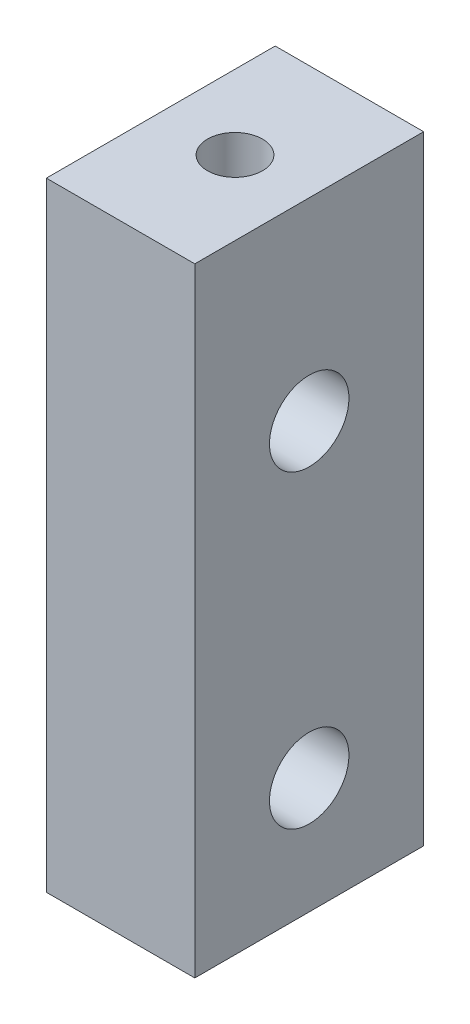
SolidWorks part; units mm, degrees
ref_plane "Front Plane" through (0, 0, 0) normal (0, 0, 1) x (1, 0, 0)
ref_plane "Top Plane" through (0, 0, 0) normal (0, 1, 0) x (1, 0, 0)
ref_plane "Right Plane" through (0, 0, 0) normal (1, 0, 0) x (0, 0, -1)
sketch "Sketch1" plane through (0, 0, 0) normal (1, 0, 0) x (0, 0, -1)
  line L1 (0, 0) -> (9.398, 0)
  line L2 (0, 0) -> (0, -25.4)
  line L3 (0, -25.4) -> (9.398, -25.4)
  line L4 (9.398, 0) -> (9.398, -25.4)
  dimension "D1" = 9.398
  dimension "D2" = 25.4
extrude "Extrude1" add sketch "Sketch1" along normal blind 6.096
hole_wizard "#4 Clearance Hole1" positions "Sketch3" profile "Sketch2" hole size "#4" standard "Ansi Inch"
sketch "Sketch3" plane through (6.096, 0, 0) normal (1, 0, 0) x (0, 0, -1)
  line L0 (9.398, -25.4) -> (9.398, 0) construction
  line L1 (9.398, 0) -> (0, 0) construction
  point P0 (4.699, -7.9375)
  point P1 (4.699, -20.6375)
  dimension "D1" = 4.699
  dimension "D2" = 7.9375
  dimension "D3" = 4.699
  dimension "D4" = 12.7
sketch "Sketch2" plane through (6.096, -7.9375, -4.699) normal (0, 1, 0) x (0, 0, -1)
  line L0 (0, 0) -> (0, 14.224)
  line L1 (0, 14.224) -> (1.6319, 14.224)
  line L2 (1.6319, 14.224) -> (1.6319, 0)
  line L5 (1.6319, 0) -> (0, 0)
  line L10 (0, 14.224) -> (-1.632, 14.224) construction
  line L11 (0, -6.35) -> (0, 107.95) construction
  dimension "Hole Dia." = 3.2639
  dimension "Hole Depth" = 14.224
  dimension "Drill Angle" = 180
hole_wizard "#4-40 Tapped Hole1" positions "Sketch5" profile "Sketch4" tap size "#4-40" standard "Ansi Inch"
sketch "Sketch5" plane through (0, 0, 0) normal (0, 1, 0) x (-1, 0, 0)
  line L0 (-6.096, 0) -> (0, 0) construction
  line L1 (0, -9.398) -> (0, 0) construction
  point P0 (-3.048, -4.699)
  dimension "D1" = 4.699
  dimension "D2" = 3.048
sketch "Sketch4" plane through (3.048, 0, -4.699) normal (1, 0, 0) x (0, 0, 1)
  line L0 (0, 0) -> (0, 5.7592)
  line L1 (0, 5.7592) -> (1.1303, 5.08)
  line L2 (1.1303, 5.08) -> (1.1303, 0)
  line L5 (1.1303, 0) -> (0, 0)
  line L10 (0, 5.7592) -> (-1.1303, 5.08) construction
  line L11 (0, -6.35) -> (0, 107.95) construction
  dimension "Tap Drill Dia." = 2.2606
  dimension "Tap Drill Depth" = 5.08
  dimension "Drill Angle" = 118
